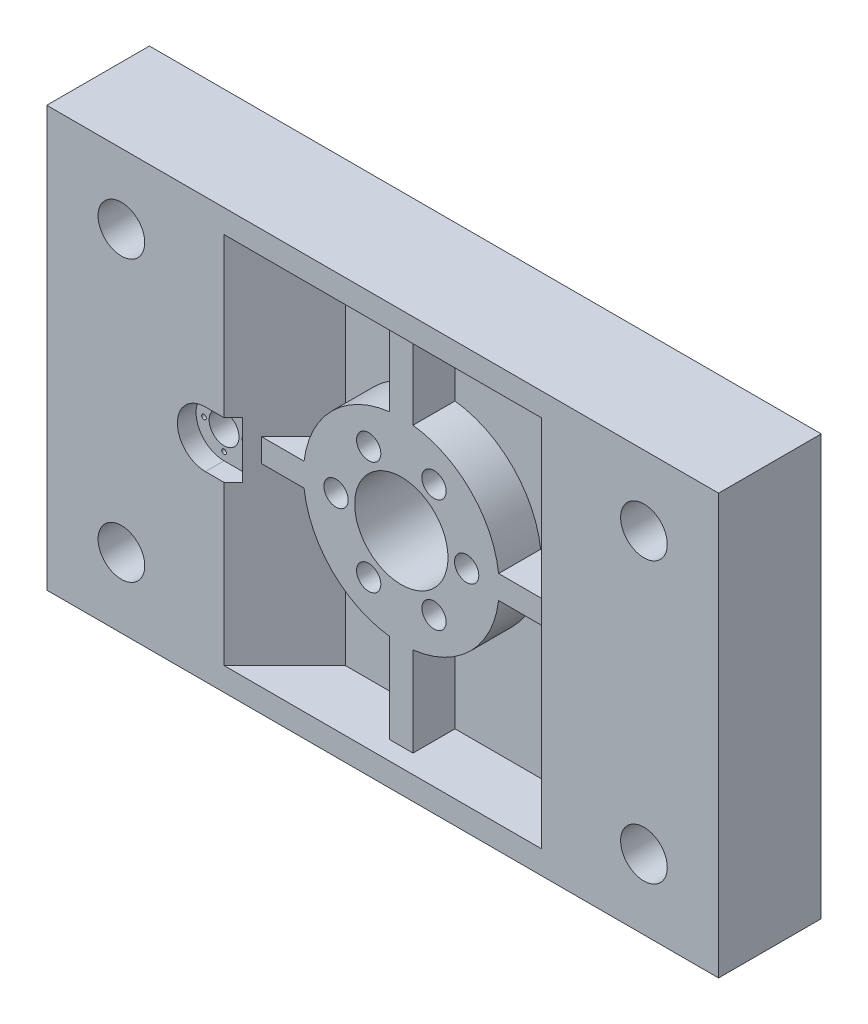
SolidWorks part; units mm, degrees
ref_plane "前视基准面" through (0, 0, 0) normal (0, 0, 1) x (1, 0, 0)
ref_plane "上视基准面" through (0, 0, 0) normal (0, 1, 0) x (1, 0, 0)
ref_plane "右视基准面" through (0, 0, 0) normal (1, 0, 0) x (0, 0, -1)
sketch "草图1" plane through (0, 0, 0) normal (0, 0, 1) x (1, 0, 0)
  line L0 (0, 0) -> (-190, 0) construction
  line L1 (360, 225) -> (-360, 225)
  line L2 (360, 225) -> (360, -225)
  line L3 (360, -225) -> (-360, -225)
  line L4 (-360, 225) -> (-360, -225)
  line L5 (360, 225) -> (-360, -225) construction
  line L6 (360, -225) -> (-360, 225) construction
  line L7 (-190, 0) -> (-189.9999, 0) construction
  line L8 (-190, 0) -> (-211.5, 0) construction
  line L9 (-189.9999, 0) -> (-189.9999, -21.5) construction
  line L10 (0, 0) -> (280, 0) construction
  line L11 (280, 0) -> (280, -150) construction
  line L12 (0, 0) -> (0, -157.0219) construction
  circle A0 centre (0, 0) radius 50
  circle A1 centre (-190, 0) radius 16
  circle A2 centre (-189.9999, -21.5) radius 2.5
  circle A3 centre (-211.5, 0) radius 2.5
  circle A4 centre (-168.4998, 0) radius 2.5
  circle A5 centre (-189.9999, 21.5) radius 2.5
  circle A6 centre (280, -150) radius 25
  circle A7 centre (280, 150) radius 25
  circle A8 centre (-280, -150) radius 25
  circle A9 centre (-280, 150) radius 25
  point P0 (0, 0)
  dimension "D1" = 720
  dimension "D2" = 450
extrude "凸台-拉伸1" add sketch "草图1" along normal blind 110
sketch "草图2" plane through (0, 0, 0) normal (0, 0, -1) x (-1, 0, 0)
  line L0 (280, 150) -> (335, 150) construction
  line L1 (335, 12.5) -> (335, 200)
  line L2 (335, 200) -> (195, 200)
  line L3 (195, 200) -> (195, 12.5)
  line L4 (195, 12.5) -> (335, 12.5)
  line L5 (0, 0) -> (-147.5751, 0) construction
  line L6 (0, 0) -> (0, 125.745) construction
  line L7 (335, -200) -> (195, -200)
  line L8 (335, -12.5) -> (335, -200)
  line L9 (195, -12.5) -> (335, -12.5)
  line L10 (195, -200) -> (195, -12.5)
  line L11 (-335, 200) -> (-195, 200)
  line L12 (-195, 12.5) -> (-335, 12.5)
  line L13 (-195, 200) -> (-195, 12.5)
  line L14 (-335, 12.5) -> (-335, 200)
  line L15 (-195, -12.5) -> (-335, -12.5)
  line L16 (-335, -12.5) -> (-335, -200)
  line L17 (-335, -200) -> (-195, -200)
  line L18 (-195, -200) -> (-195, -12.5)
extrude "切除-拉伸1" cut sketch "草图2" against normal blind 65
sketch "草图3" plane through (0, -200, 0) normal (0, 1, 0) x (1, 0, 0)
  line L0 (335, 0) -> (195, 0) construction
  line L1 (195, -65) -> (195, 0) construction
  line L2 (-195, 0) -> (-335, 0) construction
  line L3 (-195, -65) -> (-195, 0) construction
  line L4 (195, 0) -> (130, 0)
  line L5 (195, -65) -> (195, 0)
  line L6 (-130, 0) -> (-195, 0)
  line L7 (-195, -65) -> (-195, 0)
  line L8 (-195, -65) -> (-130, 0)
  line L9 (195, -65) -> (130, 0)
extrude "切除-拉伸2" cut sketch "草图3" along normal up to surface (187.5 mm away)
sketch "草图4" plane through (0, 200, 0) normal (0, -1, 0) x (1, 0, 0)
  line L0 (-195, 65) -> (-195, 0) construction
  line L1 (195, 65) -> (195, 0) construction
  line L2 (-130, 0) -> (-335, 0) construction
  line L3 (335, 0) -> (130, 0) construction
  line L4 (130, 0) -> (195, 65) construction
  line L5 (-195, 65) -> (-130, 0) construction
  line L6 (-195, 65) -> (-195, 0)
  line L7 (195, 65) -> (195, 0)
  line L8 (-130, 0) -> (-195, 0)
  line L9 (195, 0) -> (130, 0)
  line L10 (130, 0) -> (195, 65)
  line L11 (-195, 65) -> (-130, 0)
extrude "切除-拉伸3" cut sketch "草图4" along normal up to surface (187.5 mm away)
sketch "草图5" plane through (0, 0, 0) normal (0, 0, -1) x (-1, 0, 0)
  line L0 (335, -12.5) -> (199.9875, -12.5) construction
  line L1 (199.9875, 12.5) -> (335, 12.5) construction
  line L2 (130, -12.5) -> (180.0125, -12.5) construction
  line L3 (180.0125, 12.5) -> (130, 12.5) construction
  line L4 (217.2718, -12.5) -> (199.9875, -12.5)
  line L5 (199.9875, 12.5) -> (217.2718, 12.5)
  line L6 (162.7282, -12.5) -> (180.0125, -12.5)
  line L7 (180.0125, 12.5) -> (162.7282, 12.5)
  arc A0 (162.7282, -12.5) -> (217.2718, -12.5) centre (190, 0) ccw
  circle A1 centre (189.9999, -21.5) radius 2.5 construction
  circle A2 centre (189.9999, 21.5) radius 2.5 construction
  circle A3 centre (189.9999, -21.5) radius 2.5
  circle A4 centre (189.9999, 21.5) radius 2.5
  arc A5 (199.9875, 12.5) -> (180.0125, 12.5) centre (190, 0) ccw
  arc A6 (217.2718, 12.5) -> (162.7282, 12.5) centre (190, 0) ccw
  arc A7 (180.0125, -12.5) -> (199.9875, -12.5) centre (190, 0) ccw
extrude "凸台-拉伸2" add sketch "草图5" against normal up to surface (50.0125 mm away)
sketch "草图6" plane through (0, 0, 110) normal (0, 0, 1) x (1, 0, 0)
  line L1 (-105, 200) -> (105, 200)
  line L2 (-105, 200) -> (-105, -200)
  line L3 (-105, -200) -> (105, -200)
  line L4 (105, 200) -> (105, -200)
  line L5 (-105, 200) -> (105, -200) construction
  line L6 (-105, -200) -> (105, 200) construction
  point P0 (0, 0)
  dimension "D1" = 210
  dimension "D2" = 400
extrude "切除-拉伸4" cut sketch "草图6" against normal blind 65
sketch "草图7" plane through (0, 200, 0) normal (0, -1, 0) x (1, 0, 0)
  line L0 (-105, 45) -> (-105, 110) construction
  line L1 (105, 45) -> (105, 110) construction
  line L2 (105, 110) -> (-105, 110) construction
  line L3 (-105, 45) -> (-105, 110)
  line L4 (105, 45) -> (105, 110)
  line L5 (170, 110) -> (105, 110)
  line L6 (105, 45) -> (170, 110)
  line L7 (-105, 45) -> (-170, 110)
  line L8 (-105, 110) -> (-170, 110)
extrude "切除-拉伸5" cut sketch "草图7" along normal up to surface (400 mm away)
sketch "草图8" plane through (0, 0, 110) normal (0, 0, 1) x (1, 0, 0)
  line L3 (-160, 0) -> (-160, 30)
  line L4 (-190, 30) -> (-160, 30)
  line L5 (-190, -30) -> (-160, -30)
  line L6 (-160, 0) -> (-160, -30)
  arc A1 (-190, 30) -> (-190, -30) centre (-190, 0) ccw
extrude "切除-拉伸7" cut sketch "草图8" against normal blind 20
sketch "草图9" plane through (0, 0, 45) normal (0, 0, 1) x (1, 0, 0)
  line L0 (-170, -200) -> (170, -200) construction
  line L1 (0, 0) -> (-70, 0) construction
  line L2 (12.5, 200) -> (12.5, 104.2533)
  line L3 (-12.5, -104.2533) -> (-12.5, -200)
  line L4 (-12.5, 200) -> (-12.5, 104.2533)
  line L5 (12.5, 284.0157) -> (-12.5, -284.0157) construction
  line L6 (8.8023, -200) -> (-12.5, 284.0157) construction
  line L7 (170, 200) -> (-170, 200) construction
  line L8 (-12.5, -200) -> (12.5, -200)
  line L9 (12.5, 200) -> (-12.5, 200)
  line L10 (12.5, -104.2533) -> (12.5, -200)
  circle A0 centre (0, 0) radius 50 construction
  circle A1 centre (0, 0) radius 50
  arc A2 (12.5, -104.2533) -> (12.5, 104.2533) centre (0, 0) ccw
  circle A3 centre (-70, 0) radius 9
  circle A4 centre (-35, 60.6218) radius 9
  circle A5 centre (35, 60.6218) radius 9
  circle A6 centre (70, 0) radius 9
  circle A7 centre (35, -60.6218) radius 9
  circle A8 centre (-35, -60.6218) radius 9
  arc A9 (-12.5, 104.2533) -> (-12.5, -104.2533) centre (0, 0) ccw
  point P34 (0, 0)
  dimension "D1" = 6
extrude "凸台-拉伸4" add sketch "草图9" along normal blind 45
sketch "草图10" plane through (0, 0, 0) normal (0, 0, -1) x (-1, 0, 0)
  circle A0 centre (70, 0) radius 9 construction
  circle A1 centre (35, -60.6218) radius 9 construction
  circle A2 centre (-35, -60.6218) radius 9 construction
  circle A3 centre (-70, 0) radius 9 construction
  circle A4 centre (-35, 60.6218) radius 9 construction
  circle A5 centre (35, 60.6218) radius 9 construction
  circle A6 centre (70, 0) radius 9
  circle A7 centre (35, -60.6218) radius 9
  circle A8 centre (-35, -60.6218) radius 9
  circle A9 centre (-70, 0) radius 9
  circle A10 centre (-35, 60.6218) radius 9
  circle A11 centre (35, 60.6218) radius 9
extrude "切除-拉伸8" cut sketch "草图10" against normal blind 45
sketch "草图11" plane through (0, 0, 90) normal (0, 0, 1) x (1, 0, 0)
  circle A0 centre (35, 60.6218) radius 13
  circle A1 centre (-35, 60.6218) radius 13
  circle A2 centre (70, 0) radius 13
  circle A3 centre (35, -60.6218) radius 13
  circle A4 centre (-35, -60.6218) radius 13
  circle A5 centre (-70, 0) radius 13
extrude "切除-拉伸9" cut sketch "草图11" against normal blind 20
sketch "草图12" plane through (0, 0, 90) normal (0, 0, 1) x (1, 0, 0)
  line L0 (-160, -30) -> (-160, 30) construction
  line L1 (170, 12.5) -> (104.2533, 12.5)
  line L2 (-104.2533, -12.5) -> (-160, -12.5)
  line L3 (170, -12.5) -> (104.2533, -12.5)
  line L4 (-104.2533, 12.5) -> (-160, 12.5)
  line L5 (133.7228, 12.5) -> (-133.7228, -12.5) construction
  line L6 (133.7228, -12.5) -> (-133.7228, 12.5) construction
  line L7 (170, -200) -> (170, 200) construction
  line L8 (-160, -12.5) -> (-160, 12.5)
  line L9 (170, -12.5) -> (170, 12.5)
  arc A0 (12.5, -104.2533) -> (12.5, 104.2533) centre (0, 0) ccw construction
  arc A1 (-12.5, 104.2533) -> (-12.5, -104.2533) centre (0, 0) ccw construction
  arc A2 (104.2533, -12.5) -> (104.2533, 12.5) centre (0, 0) ccw
  arc A3 (-104.2533, 12.5) -> (-104.2533, -12.5) centre (0, 0) ccw
  point P0 (0, 0)
  dimension "D1" = 25
extrude "凸台-拉伸6" add sketch "草图12" against normal up to next
